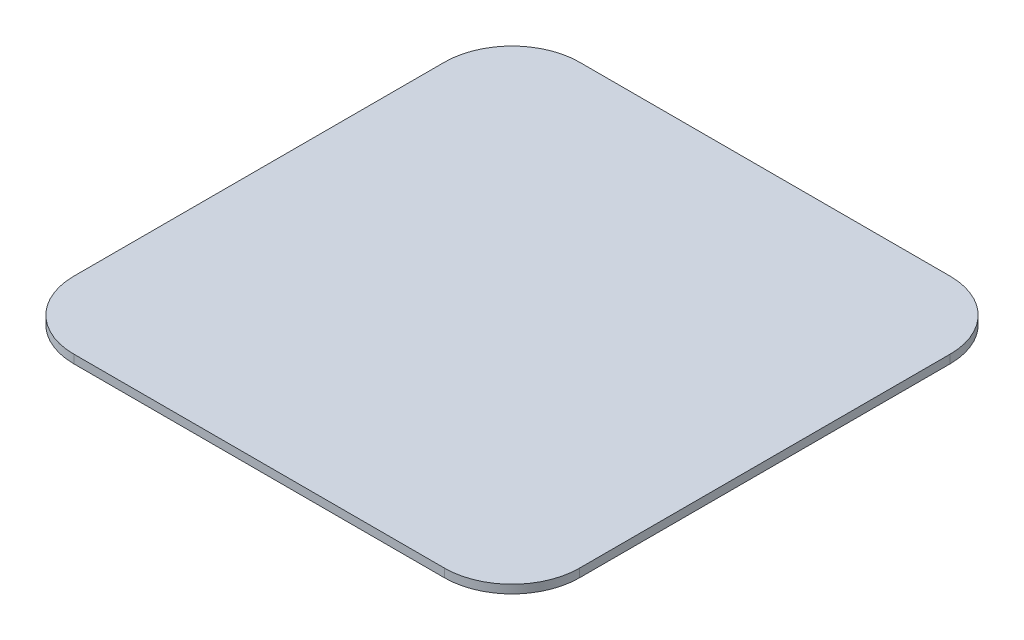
SolidWorks part; units mm, degrees
ref_plane "Alzado" through (0, 0, 0) normal (0, 0, 1) x (1, 0, 0)
ref_plane "Planta" through (0, 0, 0) normal (0, 1, 0) x (1, 0, 0)
ref_plane "Vista lateral" through (0, 0, 0) normal (1, 0, 0) x (0, 0, -1)
sketch "Croquis1" plane through (0, 0, 0) normal (0, 1, 0) x (1, 0, 0)
  line L1 (-150, 150) -> (150, 150)
  line L2 (-150, 150) -> (-150, -150)
  line L3 (-150, -150) -> (150, -150)
  line L4 (150, 150) -> (150, -150)
  line L5 (-150, 150) -> (150, -150) construction
  line L6 (-150, -150) -> (150, 150) construction
  point P0 (0, 0)
  dimension "D1" = 300
extrude "Saliente-Extruir1" add sketch "Croquis1" along normal blind 5
fillet "Redondeo1" radius 40 4 edges at (-150, 2.5, -150) (-150, 2.5, 150) (150, 2.5, -150) (150, 2.5, 150)
sketch "Croquis2" plane through (0, 0, 0) normal (0, -1, 0) x (1, 0, 0)
  line L0 (65, 30) -> (65, 50)
  line L1 (65, 30) -> (-65, 30)
  line L2 (-65, 30) -> (-65, 50)
